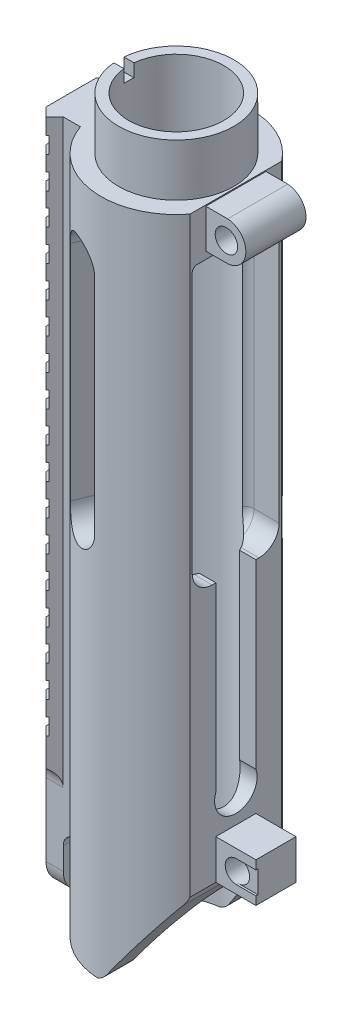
SolidWorks part; units mm, degrees
ref_plane "Front Plane" through (0, 0, 0) normal (0, 0, 1) x (1, 0, 0)
ref_plane "Top Plane" through (0, 0, 0) normal (0, 1, 0) x (1, 0, 0)
ref_plane "Right Plane" through (0, 0, 0) normal (1, 0, 0) x (0, 0, -1)
imported_body "Imported1"
sketch "Sketch1" plane through (0, 0, 0) normal (0, 0, 1) x (1, 0, 0)
  line L0 (-20.3025, -135.7614) -> (-11.9126, -135.7614)
  line L1 (-11.9126, -112.6142) -> (-17.3318, -120.3536)
  line L2 (-38.8493, -122.6566) -> (-19.2278, -122.6566) construction
  line L3 (-11.9126, -135.7614) -> (-7.5689, -135.7614)
  line L4 (-7.5689, -106.4108) -> (-11.9126, -112.6142)
  line L5 (5.2072, -95.1214) -> (15.4294, -95.1214)
  line L6 (5.2072, -95.1214) -> (3.3903, -95.1214)
  line L7 (-1.7217, -98.0601) -> (-7.5689, -106.4108)
  line L8 (-7.5689, -135.7614) -> (11.9905, -135.7614)
  line L9 (11.9905, -135.7614) -> (11.9905, -114.6794)
  line L10 (1.7741, -95.1214) -> (3.3903, -95.1214)
  line L11 (-1.1484, -97.2413) -> (-1.7217, -98.0601)
  line L12 (1.7741, -95.1214) -> (-0.1852, -95.1214)
  line L13 (-20.3025, -122.6566) -> (-41.0202, -122.6566)
  line L14 (15.4294, -95.1214) -> (10.1808, -104.109)
  line L15 (-41.0202, -122.6566) -> (-41.0202, -135.7614)
  line L16 (-41.0202, -135.7614) -> (-20.3025, -135.7614)
  arc A1 (-20.3025, -122.6566) -> (-17.3318, -120.3536) centre (-22.5334, -116.7114) ccw
  arc A2 (-1.1484, -97.2413) -> (-0.7344, -96.5635) centre (-6.35, -93.5991) ccw
  arc A3 (-0.7344, -96.5635) -> (-0.1852, -95.1214) centre (-6.35, -93.5991) ccw
  spline S1 degree 2 poles (11.9905, -114.6794) (11.7622, -114.0335) (11.5692, -113.4046) (11.3723, -112.7626) (11.2025, -112.1107) (10.8633, -110.8081) (10.6357, -109.4765) (10.4101, -108.1568) (10.2961, -106.8196) (10.1809, -105.4684) (10.1808, -104.109) knots 0 0 0 0.125 0.125 0.25 0.25 0.5 0.5 0.75 0.75 1 1 1
extrude "Cut-Extrude3" cut sketch "Sketch1" against normal mid plane 50
ref_plane "Plane1" through (0, 92.329, 0) normal (0, 1, 0) x (1, 0, 0)
sketch "Sketch2" plane through (0, 92.329, 0) normal (0, 1, 0) x (1, 0, 0)
  line L2 (-49.6697, 10.6553) -> (-52.3875, 7.9375)
  circle A0 centre (-40.5321, 0) radius 2.5845
extrude "Cut-Extrude4" cut sketch "Sketch2" against normal blind 25 contours A0
